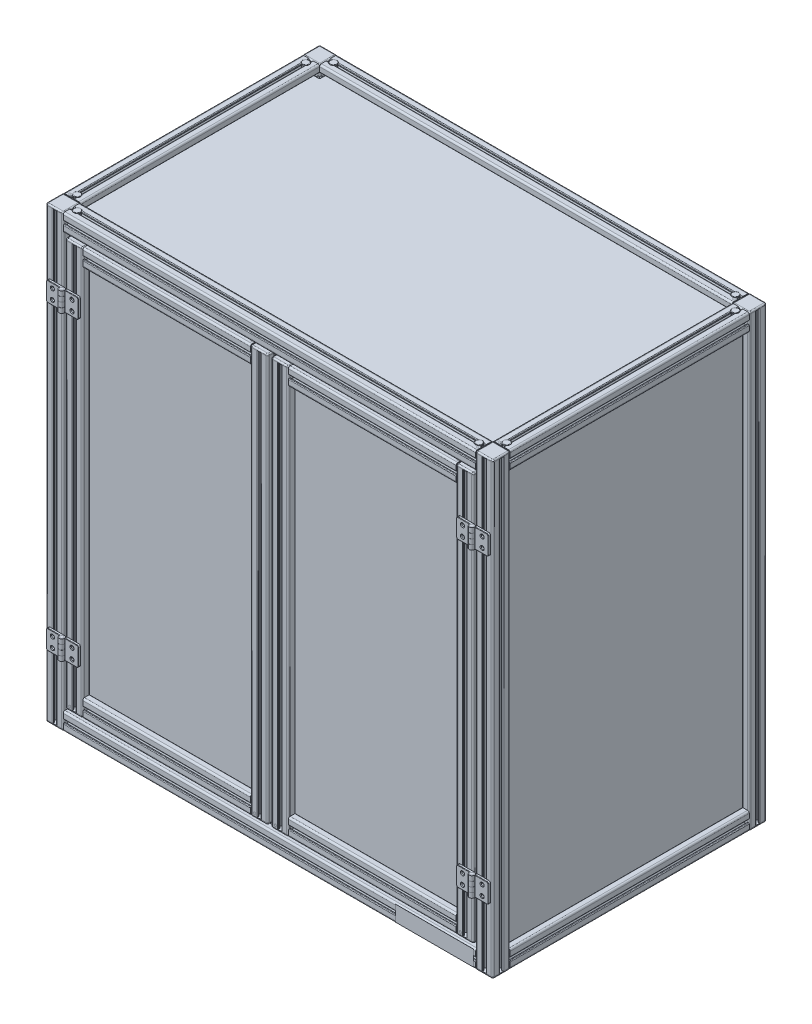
SolidWorks part; units mm, degrees
other "<202276-0001_Schutzzaun Roboterzelle V1 D - A>-<Kopie (2) von Profil 8 40x40 leicht natur^SW045361_ZV-A _ ZV-A.STEP-1/Kopie von AS0041460^Kopie (2) von Profil 8 40x40 leicht natur_SW045361.STEP-1-soli"
other "<202276-0001_Schutzzaun Roboterzelle V1 D - A>-<Kopie (2) von Profil 8 40x40 leicht natur^SW045361_ZV-A _ ZV-A.STEP-1/Kopie von AS0041460^Kopie (2) von Profil 8 40x40 leicht natur_SW045361.STEP-1-soli"
other "<202276-0001_Schutzzaun Roboterzelle V1 D - A>-<Kopie (2) von Profil 8 40x40 leicht natur^SW045361_ZV-A _ ZV-A.STEP-1/Kopie von AS0041460^Kopie (2) von Profil 8 40x40 leicht natur_SW045361.STEP-1-soli"
other "<202276-0001_Schutzzaun Roboterzelle V1 D - A>-<Kopie (2) von Profil 8 40x40 leicht natur^SW045361_ZV-A _ ZV-A.STEP-1/Profil 8 40x40 leicht natur^Kopie (2) von Profil 8 40x40 leicht natur_SW045361_ZV-"
other "<202276-0001_Schutzzaun Roboterzelle V1 D - A>-<Kopie von Profil 8 40x40 leicht natur^SW045361_-- _ --.STEP-4/Profil 8 40x40 leicht natur^Kopie von Profil 8 40x40 leicht natur_SW045361_--_--.STEP-1-so"
other "<202276-0001_Schutzzaun Roboterzelle V1 D - A>-<Kopie von Profil 8 40x40 leicht natur^SW045361_-- _ --.STEP-3/Profil 8 40x40 leicht natur^Kopie von Profil 8 40x40 leicht natur_SW045361_--_--.STEP-1-so"
other "<202276-0001_Schutzzaun Roboterzelle V1 D - A>-<Kopie von Profil 8 40x40 leicht natur^SW045361_-- _ --.STEP-2/Profil 8 40x40 leicht natur^Kopie von Profil 8 40x40 leicht natur_SW045361_--_--.STEP-1-so"
other "<202276-0001_Schutzzaun Roboterzelle V1 D - A>-<Kopie von Profil 8 40x40 leicht natur^SW045361_-- _ --.STEP-1/Profil 8 40x40 leicht natur^Kopie von Profil 8 40x40 leicht natur_SW045361_--_--.STEP-1-so"
other "<202276-0001_Schutzzaun Roboterzelle V1 D - A>-<Kopie (2) von Profil 8 40x40 leicht natur^SW045361_ZV-A _ ZV-A.STEP-3/Kopie von AS0041460^Kopie (2) von Profil 8 40x40 leicht natur_SW045361.STEP-1-soli"
other "<202276-0001_Schutzzaun Roboterzelle V1 D - A>-<Kopie (2) von Profil 8 40x40 leicht natur^SW045361_ZV-A _ ZV-A.STEP-3/Profil 8 40x40 leicht natur^Kopie (2) von Profil 8 40x40 leicht natur_SW045361_ZV-"
other "<202276-0001_Schutzzaun Roboterzelle V1 D - A>-<Kopie (2) von Profil 8 40x40 leicht natur^SW045361_ZV-A _ ZV-A.STEP-2/Kopie von AS0041460^Kopie (2) von Profil 8 40x40 leicht natur_SW045361.STEP-2-soli"
other "<202276-0001_Schutzzaun Roboterzelle V1 D - A>-<Kopie (2) von Profil 8 40x40 leicht natur^SW045361_ZV-A _ ZV-A.STEP-2/Kopie von AS0041460^Kopie (2) von Profil 8 40x40 leicht natur_SW045361.STEP-2-soli"
other "<202276-0001_Schutzzaun Roboterzelle V1 D - A>-<Kopie (2) von Profil 8 40x40 leicht natur^SW045361_ZV-A _ ZV-A.STEP-2/Kopie von AS0041460^Kopie (2) von Profil 8 40x40 leicht natur_SW045361.STEP-2-soli"
other "<202276-0001_Schutzzaun Roboterzelle V1 D - A>-<Kopie (2) von Profil 8 40x40 leicht natur^SW045361_ZV-A _ ZV-A.STEP-2/Kopie von AS0041460^Kopie (2) von Profil 8 40x40 leicht natur_SW045361.STEP-2-soli"
other "<202276-0001_Schutzzaun Roboterzelle V1 D - A>-<Kopie (2) von Profil 8 40x40 leicht natur^SW045361_ZV-A _ ZV-A.STEP-2/Kopie von AS0041460^Kopie (2) von Profil 8 40x40 leicht natur_SW045361.STEP-1-soli"
other "<202276-0001_Schutzzaun Roboterzelle V1 D - A>-<Kopie (2) von Profil 8 40x40 leicht natur^SW045361_ZV-A _ ZV-A.STEP-2/Kopie von AS0041460^Kopie (2) von Profil 8 40x40 leicht natur_SW045361.STEP-1-soli"
other "<202276-0001_Schutzzaun Roboterzelle V1 D - A>-<Kopie (2) von Profil 8 40x40 leicht natur^SW045361_ZV-A _ ZV-A.STEP-2/Kopie von AS0041460^Kopie (2) von Profil 8 40x40 leicht natur_SW045361.STEP-1-soli"
other "<202276-0001_Schutzzaun Roboterzelle V1 D - A>-<Kopie (2) von Profil 8 40x40 leicht natur^SW045361_ZV-A _ ZV-A.STEP-2/Kopie von AS0041460^Kopie (2) von Profil 8 40x40 leicht natur_SW045361.STEP-1-soli"
other "<202276-0001_Schutzzaun Roboterzelle V1 D - A>-<Kopie (2) von Profil 8 40x40 leicht natur^SW045361_ZV-A _ ZV-A.STEP-2/Profil 8 40x40 leicht natur^Kopie (2) von Profil 8 40x40 leicht natur_SW045361_ZV-"
other "<202276-0001_Schutzzaun Roboterzelle V1 D - A>-<Kopie (2) von Profil 8 40x40 leicht natur^SW045361_ZV-A _ ZV-A.STEP-1/Kopie von AS0041460^Kopie (2) von Profil 8 40x40 leicht natur_SW045361.STEP-2-soli"
other "<202276-0001_Schutzzaun Roboterzelle V1 D - A>-<Kopie (2) von Profil 8 40x40 leicht natur^SW045361_ZV-A _ ZV-A.STEP-1/Kopie von AS0041460^Kopie (2) von Profil 8 40x40 leicht natur_SW045361.STEP-2-soli"
other "<202276-0001_Schutzzaun Roboterzelle V1 D - A>-<Kopie (2) von Profil 8 40x40 leicht natur^SW045361_ZV-A _ ZV-A.STEP-1/Kopie von AS0041460^Kopie (2) von Profil 8 40x40 leicht natur_SW045361.STEP-2-soli"
other "<202276-0001_Schutzzaun Roboterzelle V1 D - A>-<Kopie (2) von Profil 8 40x40 leicht natur^SW045361_ZV-A _ ZV-A.STEP-1/Kopie von AS0041460^Kopie (2) von Profil 8 40x40 leicht natur_SW045361.STEP-2-soli"
other "<202276-0001_Schutzzaun Roboterzelle V1 D - A>-<Kopie (2) von Profil 8 40x40 leicht natur^SW045361_ZV-A _ ZV-A.STEP-1/Kopie von AS0041460^Kopie (2) von Profil 8 40x40 leicht natur_SW045361.STEP-1-soli"
other "<202276-0001_Schutzzaun Roboterzelle V1 D - A>-<Kopie (2) von Profil 8 40x40 leicht natur^SW045361_ZV-A _ ZV-A.STEP-4/Kopie von AS0041460^Kopie (2) von Profil 8 40x40 leicht natur_SW045361.STEP-2-soli"
other "<202276-0001_Schutzzaun Roboterzelle V1 D - A>-<Kopie (2) von Profil 8 40x40 leicht natur^SW045361_ZV-A _ ZV-A.STEP-4/Kopie von AS0041460^Kopie (2) von Profil 8 40x40 leicht natur_SW045361.STEP-2-soli"
other "<202276-0001_Schutzzaun Roboterzelle V1 D - A>-<Kopie (2) von Profil 8 40x40 leicht natur^SW045361_ZV-A _ ZV-A.STEP-4/Kopie von AS0041460^Kopie (2) von Profil 8 40x40 leicht natur_SW045361.STEP-2-soli"
other "<202276-0001_Schutzzaun Roboterzelle V1 D - A>-<Kopie (2) von Profil 8 40x40 leicht natur^SW045361_ZV-A _ ZV-A.STEP-4/Kopie von AS0041460^Kopie (2) von Profil 8 40x40 leicht natur_SW045361.STEP-2-soli"
other "<202276-0001_Schutzzaun Roboterzelle V1 D - A>-<Kopie (2) von Profil 8 40x40 leicht natur^SW045361_ZV-A _ ZV-A.STEP-4/Kopie von AS0041460^Kopie (2) von Profil 8 40x40 leicht natur_SW045361.STEP-1-soli"
other "<202276-0001_Schutzzaun Roboterzelle V1 D - A>-<Kopie (2) von Profil 8 40x40 leicht natur^SW045361_ZV-A _ ZV-A.STEP-4/Kopie von AS0041460^Kopie (2) von Profil 8 40x40 leicht natur_SW045361.STEP-1-soli"
other "<202276-0001_Schutzzaun Roboterzelle V1 D - A>-<Kopie (2) von Profil 8 40x40 leicht natur^SW045361_ZV-A _ ZV-A.STEP-4/Kopie von AS0041460^Kopie (2) von Profil 8 40x40 leicht natur_SW045361.STEP-1-soli"
other "<202276-0001_Schutzzaun Roboterzelle V1 D - A>-<Kopie (2) von Profil 8 40x40 leicht natur^SW045361_ZV-A _ ZV-A.STEP-4/Kopie von AS0041460^Kopie (2) von Profil 8 40x40 leicht natur_SW045361.STEP-1-soli"
other "<202276-0001_Schutzzaun Roboterzelle V1 D - A>-<Kopie (2) von Profil 8 40x40 leicht natur^SW045361_ZV-A _ ZV-A.STEP-4/Profil 8 40x40 leicht natur^Kopie (2) von Profil 8 40x40 leicht natur_SW045361_ZV-"
other "<202276-0001_Schutzzaun Roboterzelle V1 D - A>-<Kopie (2) von Profil 8 40x40 leicht natur^SW045361_ZV-A _ ZV-A.STEP-3/Kopie von AS0041460^Kopie (2) von Profil 8 40x40 leicht natur_SW045361.STEP-2-soli"
other "<202276-0001_Schutzzaun Roboterzelle V1 D - A>-<Kopie (2) von Profil 8 40x40 leicht natur^SW045361_ZV-A _ ZV-A.STEP-3/Kopie von AS0041460^Kopie (2) von Profil 8 40x40 leicht natur_SW045361.STEP-2-soli"
other "<202276-0001_Schutzzaun Roboterzelle V1 D - A>-<Kopie (2) von Profil 8 40x40 leicht natur^SW045361_ZV-A _ ZV-A.STEP-3/Kopie von AS0041460^Kopie (2) von Profil 8 40x40 leicht natur_SW045361.STEP-2-soli"
other "<202276-0001_Schutzzaun Roboterzelle V1 D - A>-<Kopie (2) von Profil 8 40x40 leicht natur^SW045361_ZV-A _ ZV-A.STEP-3/Kopie von AS0041460^Kopie (2) von Profil 8 40x40 leicht natur_SW045361.STEP-2-soli"
other "<202276-0001_Schutzzaun Roboterzelle V1 D - A>-<Kopie (2) von Profil 8 40x40 leicht natur^SW045361_ZV-A _ ZV-A.STEP-3/Kopie von AS0041460^Kopie (2) von Profil 8 40x40 leicht natur_SW045361.STEP-1-soli"
other "<202276-0001_Schutzzaun Roboterzelle V1 D - A>-<Kopie (2) von Profil 8 40x40 leicht natur^SW045361_ZV-A _ ZV-A.STEP-3/Kopie von AS0041460^Kopie (2) von Profil 8 40x40 leicht natur_SW045361.STEP-1-soli"
other "<202276-0001_Schutzzaun Roboterzelle V1 D - A>-<Kopie (2) von Profil 8 40x40 leicht natur^SW045361_ZV-A _ ZV-A.STEP-3/Kopie von AS0041460^Kopie (2) von Profil 8 40x40 leicht natur_SW045361.STEP-1-soli"
other "<202276-0001_Schutzzaun Roboterzelle V1 D - A>-<Kopie (3) von Profil 8 40x40 leicht natur^SW045361_ZV-A _ ZV-A.STEP-2/Kopie von AS0041460^Kopie (3) von Profil 8 40x40 leicht natur_SW045361.STEP-2-soli"
other "<202276-0001_Schutzzaun Roboterzelle V1 D - A>-<Kopie (3) von Profil 8 40x40 leicht natur^SW045361_ZV-A _ ZV-A.STEP-2/Kopie von AS0041460^Kopie (3) von Profil 8 40x40 leicht natur_SW045361.STEP-2-soli"
other "<202276-0001_Schutzzaun Roboterzelle V1 D - A>-<Kopie (3) von Profil 8 40x40 leicht natur^SW045361_ZV-A _ ZV-A.STEP-2/Kopie von AS0041460^Kopie (3) von Profil 8 40x40 leicht natur_SW045361.STEP-1-soli"
other "<202276-0001_Schutzzaun Roboterzelle V1 D - A>-<Kopie (3) von Profil 8 40x40 leicht natur^SW045361_ZV-A _ ZV-A.STEP-2/Kopie von AS0041460^Kopie (3) von Profil 8 40x40 leicht natur_SW045361.STEP-1-soli"
other "<202276-0001_Schutzzaun Roboterzelle V1 D - A>-<Kopie (3) von Profil 8 40x40 leicht natur^SW045361_ZV-A _ ZV-A.STEP-2/Kopie von AS0041460^Kopie (3) von Profil 8 40x40 leicht natur_SW045361.STEP-1-soli"
other "<202276-0001_Schutzzaun Roboterzelle V1 D - A>-<Kopie (3) von Profil 8 40x40 leicht natur^SW045361_ZV-A _ ZV-A.STEP-2/Kopie von AS0041460^Kopie (3) von Profil 8 40x40 leicht natur_SW045361.STEP-1-soli"
other "<202276-0001_Schutzzaun Roboterzelle V1 D - A>-<Kopie (3) von Profil 8 40x40 leicht natur^SW045361_ZV-A _ ZV-A.STEP-2/Profil 8 40x40 leicht natur^Kopie (3) von Profil 8 40x40 leicht natur_SW045361_ZV-"
other "<202276-0001_Schutzzaun Roboterzelle V1 D - A>-<Kopie (3) von Profil 8 40x40 leicht natur^SW045361_ZV-A _ ZV-A.STEP-1/Kopie von AS0041460^Kopie (3) von Profil 8 40x40 leicht natur_SW045361.STEP-2-soli"
other "<202276-0001_Schutzzaun Roboterzelle V1 D - A>-<Kopie (3) von Profil 8 40x40 leicht natur^SW045361_ZV-A _ ZV-A.STEP-1/Kopie von AS0041460^Kopie (3) von Profil 8 40x40 leicht natur_SW045361.STEP-2-soli"
other "<202276-0001_Schutzzaun Roboterzelle V1 D - A>-<Kopie (3) von Profil 8 40x40 leicht natur^SW045361_ZV-A _ ZV-A.STEP-1/Kopie von AS0041460^Kopie (3) von Profil 8 40x40 leicht natur_SW045361.STEP-2-soli"
other "<202276-0001_Schutzzaun Roboterzelle V1 D - A>-<Kopie (3) von Profil 8 40x40 leicht natur^SW045361_ZV-A _ ZV-A.STEP-1/Kopie von AS0041460^Kopie (3) von Profil 8 40x40 leicht natur_SW045361.STEP-2-soli"
other "<202276-0001_Schutzzaun Roboterzelle V1 D - A>-<Kopie (3) von Profil 8 40x40 leicht natur^SW045361_ZV-A _ ZV-A.STEP-1/Kopie von AS0041460^Kopie (3) von Profil 8 40x40 leicht natur_SW045361.STEP-1-soli"
other "<202276-0001_Schutzzaun Roboterzelle V1 D - A>-<Kopie (3) von Profil 8 40x40 leicht natur^SW045361_ZV-A _ ZV-A.STEP-1/Kopie von AS0041460^Kopie (3) von Profil 8 40x40 leicht natur_SW045361.STEP-1-soli"
other "<202276-0001_Schutzzaun Roboterzelle V1 D - A>-<Kopie (3) von Profil 8 40x40 leicht natur^SW045361_ZV-A _ ZV-A.STEP-1/Kopie von AS0041460^Kopie (3) von Profil 8 40x40 leicht natur_SW045361.STEP-1-soli"
other "<202276-0001_Schutzzaun Roboterzelle V1 D - A>-<Kopie (3) von Profil 8 40x40 leicht natur^SW045361_ZV-A _ ZV-A.STEP-1/Kopie von AS0041460^Kopie (3) von Profil 8 40x40 leicht natur_SW045361.STEP-1-soli"
other "<202276-0001_Schutzzaun Roboterzelle V1 D - A>-<Kopie (3) von Profil 8 40x40 leicht natur^SW045361_ZV-A _ ZV-A.STEP-1/Profil 8 40x40 leicht natur^Kopie (3) von Profil 8 40x40 leicht natur_SW045361_ZV-"
other "<202276-0001_Schutzzaun Roboterzelle V1 D - A>-<Kopie (3) von Profil 8 40x40 leicht natur^SW045361_ZV-A _ ZV-A.STEP-4/Kopie von AS0041460^Kopie (3) von Profil 8 40x40 leicht natur_SW045361.STEP-1-soli"
other "<202276-0001_Schutzzaun Roboterzelle V1 D - A>-<Kopie (3) von Profil 8 40x40 leicht natur^SW045361_ZV-A _ ZV-A.STEP-4/Kopie von AS0041460^Kopie (3) von Profil 8 40x40 leicht natur_SW045361.STEP-1-soli"
other "<202276-0001_Schutzzaun Roboterzelle V1 D - A>-<Kopie (3) von Profil 8 40x40 leicht natur^SW045361_ZV-A _ ZV-A.STEP-4/Kopie von AS0041460^Kopie (3) von Profil 8 40x40 leicht natur_SW045361.STEP-1-soli"
other "<202276-0001_Schutzzaun Roboterzelle V1 D - A>-<Kopie (3) von Profil 8 40x40 leicht natur^SW045361_ZV-A _ ZV-A.STEP-4/Kopie von AS0041460^Kopie (3) von Profil 8 40x40 leicht natur_SW045361.STEP-1-soli"
other "<202276-0001_Schutzzaun Roboterzelle V1 D - A>-<Kopie (3) von Profil 8 40x40 leicht natur^SW045361_ZV-A _ ZV-A.STEP-4/Profil 8 40x40 leicht natur^Kopie (3) von Profil 8 40x40 leicht natur_SW045361_ZV-"
other "<202276-0001_Schutzzaun Roboterzelle V1 D - A>-<Kopie (3) von Profil 8 40x40 leicht natur^SW045361_ZV-A _ ZV-A.STEP-3/Kopie von AS0041460^Kopie (3) von Profil 8 40x40 leicht natur_SW045361.STEP-2-soli"
other "<202276-0001_Schutzzaun Roboterzelle V1 D - A>-<Kopie (3) von Profil 8 40x40 leicht natur^SW045361_ZV-A _ ZV-A.STEP-3/Kopie von AS0041460^Kopie (3) von Profil 8 40x40 leicht natur_SW045361.STEP-2-soli"
other "<202276-0001_Schutzzaun Roboterzelle V1 D - A>-<Kopie (3) von Profil 8 40x40 leicht natur^SW045361_ZV-A _ ZV-A.STEP-3/Kopie von AS0041460^Kopie (3) von Profil 8 40x40 leicht natur_SW045361.STEP-2-soli"
other "<202276-0001_Schutzzaun Roboterzelle V1 D - A>-<Kopie (3) von Profil 8 40x40 leicht natur^SW045361_ZV-A _ ZV-A.STEP-3/Kopie von AS0041460^Kopie (3) von Profil 8 40x40 leicht natur_SW045361.STEP-2-soli"
other "<202276-0001_Schutzzaun Roboterzelle V1 D - A>-<Kopie (3) von Profil 8 40x40 leicht natur^SW045361_ZV-A _ ZV-A.STEP-3/Kopie von AS0041460^Kopie (3) von Profil 8 40x40 leicht natur_SW045361.STEP-1-soli"
other "<202276-0001_Schutzzaun Roboterzelle V1 D - A>-<Kopie (3) von Profil 8 40x40 leicht natur^SW045361_ZV-A _ ZV-A.STEP-3/Kopie von AS0041460^Kopie (3) von Profil 8 40x40 leicht natur_SW045361.STEP-1-soli"
other "<202276-0001_Schutzzaun Roboterzelle V1 D - A>-<Kopie (3) von Profil 8 40x40 leicht natur^SW045361_ZV-A _ ZV-A.STEP-3/Kopie von AS0041460^Kopie (3) von Profil 8 40x40 leicht natur_SW045361.STEP-1-soli"
other "<202276-0001_Schutzzaun Roboterzelle V1 D - A>-<Kopie (3) von Profil 8 40x40 leicht natur^SW045361_ZV-A _ ZV-A.STEP-3/Kopie von AS0041460^Kopie (3) von Profil 8 40x40 leicht natur_SW045361.STEP-1-soli"
other "<202276-0001_Schutzzaun Roboterzelle V1 D - A>-<Kopie (3) von Profil 8 40x40 leicht natur^SW045361_ZV-A _ ZV-A.STEP-3/Profil 8 40x40 leicht natur^Kopie (3) von Profil 8 40x40 leicht natur_SW045361_ZV-"
other "<202276-0001_Schutzzaun Roboterzelle V1 D - A>-<Kopie (3) von Profil 8 40x40 leicht natur^SW045361_ZV-A _ ZV-A.STEP-2/Kopie von AS0041460^Kopie (3) von Profil 8 40x40 leicht natur_SW045361.STEP-2-soli"
other "<202276-0001_Schutzzaun Roboterzelle V1 D - A>-<Kopie (3) von Profil 8 40x40 leicht natur^SW045361_ZV-A _ ZV-A.STEP-2/Kopie von AS0041460^Kopie (3) von Profil 8 40x40 leicht natur_SW045361.STEP-2-soli"
other "<202276-0001_Schutzzaun Roboterzelle V1 D - A>-<Abdeckkappen_PB08 - 08 - 40x40 (40015) s.STEP-12/Abdeckkappen_PB08 - 08 - 40x40 (40015) s-0.STEP-1-solid1>"
other "<202276-0001_Schutzzaun Roboterzelle V1 D - A>-<Abdeckkappen_PB08 - 08 - 40x40 (40015) s.STEP-11/Abdeckkappen_PB08 - 08 - 40x40 (40015) s-0.STEP-1-solid1>"
other "<202276-0001_Schutzzaun Roboterzelle V1 D - A>-<Abdeckkappen_PB08 - 08 - 40x40 (40015) s.STEP-10/Abdeckkappen_PB08 - 08 - 40x40 (40015) s-0.STEP-1-solid1>"
other "<202276-0001_Schutzzaun Roboterzelle V1 D - A>-<Abdeckkappen_PB08 - 08 - 40x40 (40015) s.STEP-9/Abdeckkappen_PB08 - 08 - 40x40 (40015) s-0.STEP-1-solid1>"
other "<202276-0001_Schutzzaun Roboterzelle V1 D - A>-<Abdeckkappen_PB08 - 08 - 40x40 (40015) s.STEP-8/Abdeckkappen_PB08 - 08 - 40x40 (40015) s-0.STEP-1-solid1>"
other "<202276-0001_Schutzzaun Roboterzelle V1 D - A>-<Abdeckkappen_PB08 - 08 - 40x40 (40015) s.STEP-7/Abdeckkappen_PB08 - 08 - 40x40 (40015) s-0.STEP-1-solid1>"
other "<202276-0001_Schutzzaun Roboterzelle V1 D - A>-<Abdeckkappen_PB08 - 08 - 40x40 (40015) s.STEP-6/Abdeckkappen_PB08 - 08 - 40x40 (40015) s-0.STEP-1-solid1>"
other "<202276-0001_Schutzzaun Roboterzelle V1 D - A>-<Abdeckkappen_PB08 - 08 - 40x40 (40015) s.STEP-5/Abdeckkappen_PB08 - 08 - 40x40 (40015) s-0.STEP-1-solid1>"
other "<202276-0001_Schutzzaun Roboterzelle V1 D - A>-<Abdeckkappen_PB08 - 08 - 40x40 (40015) s.STEP-4/Abdeckkappen_PB08 - 08 - 40x40 (40015) s-0.STEP-1-solid1>"
other "<202276-0001_Schutzzaun Roboterzelle V1 D - A>-<Abdeckkappen_PB08 - 08 - 40x40 (40015) s.STEP-3/Abdeckkappen_PB08 - 08 - 40x40 (40015) s-0.STEP-1-solid1>"
other "<202276-0001_Schutzzaun Roboterzelle V1 D - A>-<Abdeckkappen_PB08 - 08 - 40x40 (40015) s.STEP-2/Abdeckkappen_PB08 - 08 - 40x40 (40015) s-0.STEP-1-solid1>"
other "<202276-0001_Schutzzaun Roboterzelle V1 D - A>-<Abdeckkappen_PB08 - 08 - 40x40 (40015) s.STEP-1/Abdeckkappen_PB08 - 08 - 40x40 (40015) s-0.STEP-1-solid1>"
other "<202276-0001_Schutzzaun Roboterzelle V1 D - A>-<Kopie (3) von Profil 8 40x40 leicht natur^SW045361_ZV-A _ ZV-A.STEP-4/Kopie von AS0041460^Kopie (3) von Profil 8 40x40 leicht natur_SW045361.STEP-2-soli"
other "<202276-0001_Schutzzaun Roboterzelle V1 D - A>-<Kopie (3) von Profil 8 40x40 leicht natur^SW045361_ZV-A _ ZV-A.STEP-4/Kopie von AS0041460^Kopie (3) von Profil 8 40x40 leicht natur_SW045361.STEP-2-soli"
other "<202276-0001_Schutzzaun Roboterzelle V1 D - A>-<Kopie (3) von Profil 8 40x40 leicht natur^SW045361_ZV-A _ ZV-A.STEP-4/Kopie von AS0041460^Kopie (3) von Profil 8 40x40 leicht natur_SW045361.STEP-2-soli"
other "<202276-0001_Schutzzaun Roboterzelle V1 D - A>-<Kopie (3) von Profil 8 40x40 leicht natur^SW045361_ZV-A _ ZV-A.STEP-4/Kopie von AS0041460^Kopie (3) von Profil 8 40x40 leicht natur_SW045361.STEP-2-soli"
other "<202276-0001_Schutzzaun Roboterzelle V1 D - A>-<Kopie (5) von Profil 8 40x40 leicht natur^SW045361_ZV-A _ ZV-A.STEP-1/Kopie von AS0041460^Kopie (5) von Profil 8 40x40 leicht natur_SW045361.STEP-2-soli"
other "<202276-0001_Schutzzaun Roboterzelle V1 D - A>-<Kopie (5) von Profil 8 40x40 leicht natur^SW045361_ZV-A _ ZV-A.STEP-1/Kopie von AS0041460^Kopie (5) von Profil 8 40x40 leicht natur_SW045361.STEP-2-soli"
other "<202276-0001_Schutzzaun Roboterzelle V1 D - A>-<Kopie (5) von Profil 8 40x40 leicht natur^SW045361_ZV-A _ ZV-A.STEP-1/Kopie von AS0041460^Kopie (5) von Profil 8 40x40 leicht natur_SW045361.STEP-2-soli"
other "<202276-0001_Schutzzaun Roboterzelle V1 D - A>-<Kopie (5) von Profil 8 40x40 leicht natur^SW045361_ZV-A _ ZV-A.STEP-1/Kopie von AS0041460^Kopie (5) von Profil 8 40x40 leicht natur_SW045361.STEP-1-soli"
other "<202276-0001_Schutzzaun Roboterzelle V1 D - A>-<Kopie (5) von Profil 8 40x40 leicht natur^SW045361_ZV-A _ ZV-A.STEP-1/Kopie von AS0041460^Kopie (5) von Profil 8 40x40 leicht natur_SW045361.STEP-1-soli"
other "<202276-0001_Schutzzaun Roboterzelle V1 D - A>-<Kopie (5) von Profil 8 40x40 leicht natur^SW045361_ZV-A _ ZV-A.STEP-1/Kopie von AS0041460^Kopie (5) von Profil 8 40x40 leicht natur_SW045361.STEP-1-soli"
other "<202276-0001_Schutzzaun Roboterzelle V1 D - A>-<Kopie (5) von Profil 8 40x40 leicht natur^SW045361_ZV-A _ ZV-A.STEP-1/Kopie von AS0041460^Kopie (5) von Profil 8 40x40 leicht natur_SW045361.STEP-1-soli"
other "<202276-0001_Schutzzaun Roboterzelle V1 D - A>-<Kopie (5) von Profil 8 40x40 leicht natur^SW045361_ZV-A _ ZV-A.STEP-1/Profil 8 40x40 leicht natur^Kopie (5) von Profil 8 40x40 leicht natur_SW045361_ZV-"
other "<202276-0001_Schutzzaun Roboterzelle V1 D - A>-<Kopie (4) von Profil 8 40x40 leicht natur^SW045361_-- _ --.STEP-4/Profil 8 40x40 leicht natur^Kopie (4) von Profil 8 40x40 leicht natur_SW045361_--_--.S"
other "<202276-0001_Schutzzaun Roboterzelle V1 D - A>-<Kopie (4) von Profil 8 40x40 leicht natur^SW045361_-- _ --.STEP-3/Profil 8 40x40 leicht natur^Kopie (4) von Profil 8 40x40 leicht natur_SW045361_--_--.S"
other "<202276-0001_Schutzzaun Roboterzelle V1 D - A>-<Kopie (4) von Profil 8 40x40 leicht natur^SW045361_-- _ --.STEP-2/Profil 8 40x40 leicht natur^Kopie (4) von Profil 8 40x40 leicht natur_SW045361_--_--.S"
other "<202276-0001_Schutzzaun Roboterzelle V1 D - A>-<Kopie (4) von Profil 8 40x40 leicht natur^SW045361_-- _ --.STEP-1/Profil 8 40x40 leicht natur^Kopie (4) von Profil 8 40x40 leicht natur_SW045361_--_--.S"
other "<202276-0001_Schutzzaun Roboterzelle V1 D - A>-<Abdeckkappen_PB08 - 08 - 40x40 (40015) s.STEP-16/Abdeckkappen_PB08 - 08 - 40x40 (40015) s-0.STEP-1-solid1>"
other "<202276-0001_Schutzzaun Roboterzelle V1 D - A>-<Abdeckkappen_PB08 - 08 - 40x40 (40015) s.STEP-15/Abdeckkappen_PB08 - 08 - 40x40 (40015) s-0.STEP-1-solid1>"
other "<202276-0001_Schutzzaun Roboterzelle V1 D - A>-<Abdeckkappen_PB08 - 08 - 40x40 (40015) s.STEP-14/Abdeckkappen_PB08 - 08 - 40x40 (40015) s-0.STEP-1-solid1>"
other "<202276-0001_Schutzzaun Roboterzelle V1 D - A>-<Abdeckkappen_PB08 - 08 - 40x40 (40015) s.STEP-13/Abdeckkappen_PB08 - 08 - 40x40 (40015) s-0.STEP-1-solid1>"
other "<202276-0001_Schutzzaun Roboterzelle V1 D - A>-<Kopie (5) von Profil 8 40x40 leicht natur^SW045361_ZV-A _ ZV-A.STEP-3/Kopie von AS0041460^Kopie (5) von Profil 8 40x40 leicht natur_SW045361.STEP-2-soli"
other "<202276-0001_Schutzzaun Roboterzelle V1 D - A>-<Kopie (5) von Profil 8 40x40 leicht natur^SW045361_ZV-A _ ZV-A.STEP-3/Kopie von AS0041460^Kopie (5) von Profil 8 40x40 leicht natur_SW045361.STEP-1-soli"
other "<202276-0001_Schutzzaun Roboterzelle V1 D - A>-<Kopie (5) von Profil 8 40x40 leicht natur^SW045361_ZV-A _ ZV-A.STEP-3/Kopie von AS0041460^Kopie (5) von Profil 8 40x40 leicht natur_SW045361.STEP-1-soli"
other "<202276-0001_Schutzzaun Roboterzelle V1 D - A>-<Kopie (5) von Profil 8 40x40 leicht natur^SW045361_ZV-A _ ZV-A.STEP-3/Kopie von AS0041460^Kopie (5) von Profil 8 40x40 leicht natur_SW045361.STEP-1-soli"
other "<202276-0001_Schutzzaun Roboterzelle V1 D - A>-<Kopie (5) von Profil 8 40x40 leicht natur^SW045361_ZV-A _ ZV-A.STEP-3/Kopie von AS0041460^Kopie (5) von Profil 8 40x40 leicht natur_SW045361.STEP-1-soli"
other "<202276-0001_Schutzzaun Roboterzelle V1 D - A>-<Kopie (5) von Profil 8 40x40 leicht natur^SW045361_ZV-A _ ZV-A.STEP-3/Profil 8 40x40 leicht natur^Kopie (5) von Profil 8 40x40 leicht natur_SW045361_ZV-"
other "<202276-0001_Schutzzaun Roboterzelle V1 D - A>-<Kopie (5) von Profil 8 40x40 leicht natur^SW045361_ZV-A _ ZV-A.STEP-2/Kopie von AS0041460^Kopie (5) von Profil 8 40x40 leicht natur_SW045361.STEP-2-soli"
other "<202276-0001_Schutzzaun Roboterzelle V1 D - A>-<Kopie (5) von Profil 8 40x40 leicht natur^SW045361_ZV-A _ ZV-A.STEP-2/Kopie von AS0041460^Kopie (5) von Profil 8 40x40 leicht natur_SW045361.STEP-2-soli"
other "<202276-0001_Schutzzaun Roboterzelle V1 D - A>-<Kopie (5) von Profil 8 40x40 leicht natur^SW045361_ZV-A _ ZV-A.STEP-2/Kopie von AS0041460^Kopie (5) von Profil 8 40x40 leicht natur_SW045361.STEP-2-soli"
other "<202276-0001_Schutzzaun Roboterzelle V1 D - A>-<Kopie (5) von Profil 8 40x40 leicht natur^SW045361_ZV-A _ ZV-A.STEP-2/Kopie von AS0041460^Kopie (5) von Profil 8 40x40 leicht natur_SW045361.STEP-2-soli"
other "<202276-0001_Schutzzaun Roboterzelle V1 D - A>-<Kopie (5) von Profil 8 40x40 leicht natur^SW045361_ZV-A _ ZV-A.STEP-2/Kopie von AS0041460^Kopie (5) von Profil 8 40x40 leicht natur_SW045361.STEP-1-soli"
other "<202276-0001_Schutzzaun Roboterzelle V1 D - A>-<Kopie (5) von Profil 8 40x40 leicht natur^SW045361_ZV-A _ ZV-A.STEP-2/Kopie von AS0041460^Kopie (5) von Profil 8 40x40 leicht natur_SW045361.STEP-1-soli"
other "<202276-0001_Schutzzaun Roboterzelle V1 D - A>-<Kopie (5) von Profil 8 40x40 leicht natur^SW045361_ZV-A _ ZV-A.STEP-2/Kopie von AS0041460^Kopie (5) von Profil 8 40x40 leicht natur_SW045361.STEP-1-soli"
other "<202276-0001_Schutzzaun Roboterzelle V1 D - A>-<Kopie (5) von Profil 8 40x40 leicht natur^SW045361_ZV-A _ ZV-A.STEP-2/Kopie von AS0041460^Kopie (5) von Profil 8 40x40 leicht natur_SW045361.STEP-1-soli"
other "<202276-0001_Schutzzaun Roboterzelle V1 D - A>-<Kopie (5) von Profil 8 40x40 leicht natur^SW045361_ZV-A _ ZV-A.STEP-2/Profil 8 40x40 leicht natur^Kopie (5) von Profil 8 40x40 leicht natur_SW045361_ZV-"
other "<202276-0001_Schutzzaun Roboterzelle V1 D - A>-<Kopie (5) von Profil 8 40x40 leicht natur^SW045361_ZV-A _ ZV-A.STEP-1/Kopie von AS0041460^Kopie (5) von Profil 8 40x40 leicht natur_SW045361.STEP-2-soli"
other "<202276-0001_Schutzzaun Roboterzelle V1 D - A>-<Universalwinkel_ohne Befestigungssatz.STEP-4/Universalwinkelsaetze_Universalwinkel ESD.STEP-1-solid1>"
other "<202276-0001_Schutzzaun Roboterzelle V1 D - A>-<Universalwinkel_ohne Befestigungssatz.STEP-3/Universalwinkelsaetze_Universalwinkel ESD.STEP-1-solid1>"
other "<202276-0001_Schutzzaun Roboterzelle V1 D - A>-<Universalwinkel_ohne Befestigungssatz.STEP-2/Universalwinkelsaetze_Universalwinkel ESD.STEP-1-solid1>"
other "<202276-0001_Schutzzaun Roboterzelle V1 D - A>-<Universalwinkel_ohne Befestigungssatz.STEP-1/Universalwinkelsaetze_Universalwinkel ESD.STEP-1-solid1>"
other "<202276-0001_Schutzzaun Roboterzelle V1 D - A>-<Kopie (5) von Profil 8 40x40 leicht natur^SW045361_ZV-A _ ZV-A.STEP-4/Kopie von AS0041460^Kopie (5) von Profil 8 40x40 leicht natur_SW045361.STEP-2-soli"
other "<202276-0001_Schutzzaun Roboterzelle V1 D - A>-<Kopie (5) von Profil 8 40x40 leicht natur^SW045361_ZV-A _ ZV-A.STEP-4/Kopie von AS0041460^Kopie (5) von Profil 8 40x40 leicht natur_SW045361.STEP-2-soli"
other "<202276-0001_Schutzzaun Roboterzelle V1 D - A>-<Kopie (5) von Profil 8 40x40 leicht natur^SW045361_ZV-A _ ZV-A.STEP-4/Kopie von AS0041460^Kopie (5) von Profil 8 40x40 leicht natur_SW045361.STEP-2-soli"
other "<202276-0001_Schutzzaun Roboterzelle V1 D - A>-<Kopie (5) von Profil 8 40x40 leicht natur^SW045361_ZV-A _ ZV-A.STEP-4/Kopie von AS0041460^Kopie (5) von Profil 8 40x40 leicht natur_SW045361.STEP-2-soli"
other "<202276-0001_Schutzzaun Roboterzelle V1 D - A>-<Kopie (5) von Profil 8 40x40 leicht natur^SW045361_ZV-A _ ZV-A.STEP-4/Kopie von AS0041460^Kopie (5) von Profil 8 40x40 leicht natur_SW045361.STEP-1-soli"
other "<202276-0001_Schutzzaun Roboterzelle V1 D - A>-<Kopie (5) von Profil 8 40x40 leicht natur^SW045361_ZV-A _ ZV-A.STEP-4/Kopie von AS0041460^Kopie (5) von Profil 8 40x40 leicht natur_SW045361.STEP-1-soli"
other "<202276-0001_Schutzzaun Roboterzelle V1 D - A>-<Kopie (5) von Profil 8 40x40 leicht natur^SW045361_ZV-A _ ZV-A.STEP-4/Kopie von AS0041460^Kopie (5) von Profil 8 40x40 leicht natur_SW045361.STEP-1-soli"
other "<202276-0001_Schutzzaun Roboterzelle V1 D - A>-<Kopie (5) von Profil 8 40x40 leicht natur^SW045361_ZV-A _ ZV-A.STEP-4/Kopie von AS0041460^Kopie (5) von Profil 8 40x40 leicht natur_SW045361.STEP-1-soli"
other "<202276-0001_Schutzzaun Roboterzelle V1 D - A>-<Kopie (5) von Profil 8 40x40 leicht natur^SW045361_ZV-A _ ZV-A.STEP-4/Profil 8 40x40 leicht natur^Kopie (5) von Profil 8 40x40 leicht natur_SW045361_ZV-"
other "<202276-0001_Schutzzaun Roboterzelle V1 D - A>-<Kopie (5) von Profil 8 40x40 leicht natur^SW045361_ZV-A _ ZV-A.STEP-3/Kopie von AS0041460^Kopie (5) von Profil 8 40x40 leicht natur_SW045361.STEP-2-soli"
other "<202276-0001_Schutzzaun Roboterzelle V1 D - A>-<Kopie (5) von Profil 8 40x40 leicht natur^SW045361_ZV-A _ ZV-A.STEP-3/Kopie von AS0041460^Kopie (5) von Profil 8 40x40 leicht natur_SW045361.STEP-2-soli"
other "<202276-0001_Schutzzaun Roboterzelle V1 D - A>-<Kopie (5) von Profil 8 40x40 leicht natur^SW045361_ZV-A _ ZV-A.STEP-3/Kopie von AS0041460^Kopie (5) von Profil 8 40x40 leicht natur_SW045361.STEP-2-soli"
other "<202276-0001_Schutzzaun Roboterzelle V1 D - A>-<SW045362_HPL - 05.STEP-1-solid1>"
other "<202276-0001_Schutzzaun Roboterzelle V1 D - A>-<AS0010452.STEP-2-solid1>"
other "<202276-0001_Schutzzaun Roboterzelle V1 D - A>-<AS0010452.STEP-1-solid1>"
other "<202276-0001_Schutzzaun Roboterzelle V1 D - A>-<Typenschild-Aufkleber_Normal.STEP-1/Typenschild-Aufkleber_Typenschild.STEP-1-solid1>"
other "<202276-0001_Schutzzaun Roboterzelle V1 D - A>-<AS0013820.STEP-4/AS0013820_02.STEP-2-solid1>"
other "<202276-0001_Schutzzaun Roboterzelle V1 D - A>-<AS0013820.STEP-4/AS0013820_02.STEP-1-solid1>"
other "<202276-0001_Schutzzaun Roboterzelle V1 D - A>-<AS0013820.STEP-4/AS0013820_01.STEP-1-solid1>"
other "<202276-0001_Schutzzaun Roboterzelle V1 D - A>-<AS0013820.STEP-3/AS0013820_02.STEP-2-solid1>"
other "<202276-0001_Schutzzaun Roboterzelle V1 D - A>-<AS0013820.STEP-3/AS0013820_02.STEP-1-solid1>"
other "<202276-0001_Schutzzaun Roboterzelle V1 D - A>-<AS0013820.STEP-3/AS0013820_01.STEP-1-solid1>"
other "<202276-0001_Schutzzaun Roboterzelle V1 D - A>-<AS0013820.STEP-2/AS0013820_02.STEP-2-solid1>"
other "<202276-0001_Schutzzaun Roboterzelle V1 D - A>-<AS0013820.STEP-2/AS0013820_02.STEP-1-solid1>"
other "<202276-0001_Schutzzaun Roboterzelle V1 D - A>-<AS0013820.STEP-2/AS0013820_01.STEP-1-solid1>"
other "<202276-0001_Schutzzaun Roboterzelle V1 D - A>-<AS0013820.STEP-1/AS0013820_02.STEP-2-solid1>"
other "<202276-0001_Schutzzaun Roboterzelle V1 D - A>-<AS0013820.STEP-1/AS0013820_02.STEP-1-solid1>"
other "<202276-0001_Schutzzaun Roboterzelle V1 D - A>-<AS0013820.STEP-1/AS0013820_01.STEP-1-solid1>"
other "<202276-0001_Schutzzaun Roboterzelle V1 D - A>-<SW045365_HPL - 05.STEP-1-solid1>"
other "<202276-0001_Schutzzaun Roboterzelle V1 D - A>-<SW045364_HPL - 05.STEP-2-solid1>"
other "<202276-0001_Schutzzaun Roboterzelle V1 D - A>-<SW045364_HPL - 05.STEP-1-solid1>"
other "<202276-0001_Schutzzaun Roboterzelle V1 D - A>-<SW045363_HPL - 05.STEP-1-solid1>"
other "<202276-0001_Schutzzaun Roboterzelle V1 D - A>-<SW045362_HPL - 05.STEP-2-solid1>"
ref_plane "Ebene vorne" through (0, 0, 0) normal (0, 0, 1) x (1, 0, 0)
ref_plane "Ebene oben" through (0, 0, 0) normal (0, 1, 0) x (1, 0, 0)
ref_plane "Ebene rechts" through (0, 0, 0) normal (1, 0, 0) x (0, 0, -1)
imported_body "Kopie von Profil 8 40x40 leicht natur^SW045361_-- _ ---1/Profil 8 40x40 leicht natur^Kopie von Profil 8 40x40 leicht natur_SW045361_--_---1-solid1"
imported_body "Kopie von Profil 8 40x40 leicht natur^SW045361_-- _ ---2/Profil 8 40x40 leicht natur^Kopie von Profil 8 40x40 leicht natur_SW045361_--_---1-solid1"
imported_body "Kopie von Profil 8 40x40 leicht natur^SW045361_-- _ ---3/Profil 8 40x40 leicht natur^Kopie von Profil 8 40x40 leicht natur_SW045361_--_---1-solid1"
imported_body "Kopie von Profil 8 40x40 leicht natur^SW045361_-- _ ---4/Profil 8 40x40 leicht natur^Kopie von Profil 8 40x40 leicht natur_SW045361_--_---1-solid1"
imported_body "Kopie (2) von Profil 8 40x40 leicht natur^SW045361_A-A _ A-A-1/Profil 8 40x40 leicht natur^Kopie (2) von Profil 8 40x40 leicht natur_SW045361_A-A _ A-A-1-solid1"
imported_body "Kopie (2) von Profil 8 40x40 leicht natur^SW045361_A-A _ A-A-1/Kopie von Automatikverbinder^Kopie (2) von Profil 8 40x40 leicht natur_SW045361_PB 8 - Nut 8-1/Kopie von Automatikverbinder Huelse^Kopie "
imported_body "Kopie (2) von Profil 8 40x40 leicht natur^SW045361_A-A _ A-A-1/Kopie von Automatikverbinder^Kopie (2) von Profil 8 40x40 leicht natur_SW045361_PB 8 - Nut 8-1/Automatikverbinder Schraube^Kopie von Auto"
imported_body "Kopie (2) von Profil 8 40x40 leicht natur^SW045361_A-A _ A-A-1/Kopie von Automatikverbinder^Kopie (2) von Profil 8 40x40 leicht natur_SW045361_PB 8 - Nut 8-1/Automatikverbinder Nutenstein^Kopie von Au"
imported_body "Kopie (2) von Profil 8 40x40 leicht natur^SW045361_A-A _ A-A-1/Kopie von Automatikverbinder^Kopie (2) von Profil 8 40x40 leicht natur_SW045361_PB 8 - Nut 8-2/Kopie von Automatikverbinder Huelse^Kopie "
imported_body "Kopie (2) von Profil 8 40x40 leicht natur^SW045361_A-A _ A-A-1/Kopie von Automatikverbinder^Kopie (2) von Profil 8 40x40 leicht natur_SW045361_PB 8 - Nut 8-2/Automatikverbinder Schraube^Kopie von Auto"
imported_body "Kopie (2) von Profil 8 40x40 leicht natur^SW045361_A-A _ A-A-1/Kopie von Automatikverbinder^Kopie (2) von Profil 8 40x40 leicht natur_SW045361_PB 8 - Nut 8-2/Automatikverbinder Nutenstein^Kopie von Au"
imported_body "Kopie (2) von Profil 8 40x40 leicht natur^SW045361_A-A _ A-A-2/Profil 8 40x40 leicht natur^Kopie (2) von Profil 8 40x40 leicht natur_SW045361_A-A _ A-A-1-solid1"
imported_body "Kopie (2) von Profil 8 40x40 leicht natur^SW045361_A-A _ A-A-2/Kopie von Automatikverbinder^Kopie (2) von Profil 8 40x40 leicht natur_SW045361_PB 8 - Nut 8-1/Kopie von Automatikverbinder Huelse^Kopie "
imported_body "Kopie (2) von Profil 8 40x40 leicht natur^SW045361_A-A _ A-A-2/Kopie von Automatikverbinder^Kopie (2) von Profil 8 40x40 leicht natur_SW045361_PB 8 - Nut 8-1/Automatikverbinder Schraube^Kopie von Auto"
imported_body "Kopie (2) von Profil 8 40x40 leicht natur^SW045361_A-A _ A-A-2/Kopie von Automatikverbinder^Kopie (2) von Profil 8 40x40 leicht natur_SW045361_PB 8 - Nut 8-1/Automatikverbinder Nutenstein^Kopie von Au"
imported_body "Kopie (2) von Profil 8 40x40 leicht natur^SW045361_A-A _ A-A-2/Kopie von Automatikverbinder^Kopie (2) von Profil 8 40x40 leicht natur_SW045361_PB 8 - Nut 8-2/Kopie von Automatikverbinder Huelse^Kopie "
imported_body "Kopie (2) von Profil 8 40x40 leicht natur^SW045361_A-A _ A-A-2/Kopie von Automatikverbinder^Kopie (2) von Profil 8 40x40 leicht natur_SW045361_PB 8 - Nut 8-2/Automatikverbinder Schraube^Kopie von Auto"
imported_body "Kopie (2) von Profil 8 40x40 leicht natur^SW045361_A-A _ A-A-2/Kopie von Automatikverbinder^Kopie (2) von Profil 8 40x40 leicht natur_SW045361_PB 8 - Nut 8-2/Automatikverbinder Nutenstein^Kopie von Au"
imported_body "Kopie (2) von Profil 8 40x40 leicht natur^SW045361_A-A _ A-A-3/Profil 8 40x40 leicht natur^Kopie (2) von Profil 8 40x40 leicht natur_SW045361_A-A _ A-A-1-solid1"
imported_body "Kopie (2) von Profil 8 40x40 leicht natur^SW045361_A-A _ A-A-3/Kopie von Automatikverbinder^Kopie (2) von Profil 8 40x40 leicht natur_SW045361_PB 8 - Nut 8-1/Kopie von Automatikverbinder Huelse^Kopie "
imported_body "Kopie (2) von Profil 8 40x40 leicht natur^SW045361_A-A _ A-A-3/Kopie von Automatikverbinder^Kopie (2) von Profil 8 40x40 leicht natur_SW045361_PB 8 - Nut 8-1/Automatikverbinder Schraube^Kopie von Auto"
imported_body "Kopie (2) von Profil 8 40x40 leicht natur^SW045361_A-A _ A-A-3/Kopie von Automatikverbinder^Kopie (2) von Profil 8 40x40 leicht natur_SW045361_PB 8 - Nut 8-1/Automatikverbinder Nutenstein^Kopie von Au"
imported_body "Kopie (2) von Profil 8 40x40 leicht natur^SW045361_A-A _ A-A-3/Kopie von Automatikverbinder^Kopie (2) von Profil 8 40x40 leicht natur_SW045361_PB 8 - Nut 8-2/Kopie von Automatikverbinder Huelse^Kopie "
imported_body "Kopie (2) von Profil 8 40x40 leicht natur^SW045361_A-A _ A-A-3/Kopie von Automatikverbinder^Kopie (2) von Profil 8 40x40 leicht natur_SW045361_PB 8 - Nut 8-2/Automatikverbinder Schraube^Kopie von Auto"
imported_body "Kopie (2) von Profil 8 40x40 leicht natur^SW045361_A-A _ A-A-3/Kopie von Automatikverbinder^Kopie (2) von Profil 8 40x40 leicht natur_SW045361_PB 8 - Nut 8-2/Automatikverbinder Nutenstein^Kopie von Au"
imported_body "Kopie (2) von Profil 8 40x40 leicht natur^SW045361_A-A _ A-A-4/Profil 8 40x40 leicht natur^Kopie (2) von Profil 8 40x40 leicht natur_SW045361_A-A _ A-A-1-solid1"
imported_body "Kopie (2) von Profil 8 40x40 leicht natur^SW045361_A-A _ A-A-4/Kopie von Automatikverbinder^Kopie (2) von Profil 8 40x40 leicht natur_SW045361_PB 8 - Nut 8-1/Kopie von Automatikverbinder Huelse^Kopie "
imported_body "Kopie (2) von Profil 8 40x40 leicht natur^SW045361_A-A _ A-A-4/Kopie von Automatikverbinder^Kopie (2) von Profil 8 40x40 leicht natur_SW045361_PB 8 - Nut 8-1/Automatikverbinder Schraube^Kopie von Auto"
imported_body "Kopie (2) von Profil 8 40x40 leicht natur^SW045361_A-A _ A-A-4/Kopie von Automatikverbinder^Kopie (2) von Profil 8 40x40 leicht natur_SW045361_PB 8 - Nut 8-1/Automatikverbinder Nutenstein^Kopie von Au"
imported_body "Kopie (2) von Profil 8 40x40 leicht natur^SW045361_A-A _ A-A-4/Kopie von Automatikverbinder^Kopie (2) von Profil 8 40x40 leicht natur_SW045361_PB 8 - Nut 8-2/Kopie von Automatikverbinder Huelse^Kopie "
imported_body "Kopie (2) von Profil 8 40x40 leicht natur^SW045361_A-A _ A-A-4/Kopie von Automatikverbinder^Kopie (2) von Profil 8 40x40 leicht natur_SW045361_PB 8 - Nut 8-2/Automatikverbinder Schraube^Kopie von Auto"
imported_body "Kopie (2) von Profil 8 40x40 leicht natur^SW045361_A-A _ A-A-4/Kopie von Automatikverbinder^Kopie (2) von Profil 8 40x40 leicht natur_SW045361_PB 8 - Nut 8-2/Automatikverbinder Nutenstein^Kopie von Au"
imported_body "Kopie (3) von Profil 8 40x40 leicht natur^SW045361_A-A _ A-A-1/Profil 8 40x40 leicht natur^Kopie (3) von Profil 8 40x40 leicht natur_SW045361_A-A _ A-A-1-solid1"
imported_body "Kopie (3) von Profil 8 40x40 leicht natur^SW045361_A-A _ A-A-1/Kopie von Automatikverbinder^Kopie (3) von Profil 8 40x40 leicht natur_SW045361_PB 8 - Nut 8-1/Kopie von Automatikverbinder Huelse^Kopie "
imported_body "Kopie (3) von Profil 8 40x40 leicht natur^SW045361_A-A _ A-A-1/Kopie von Automatikverbinder^Kopie (3) von Profil 8 40x40 leicht natur_SW045361_PB 8 - Nut 8-1/Automatikverbinder Schraube^Kopie von Auto"
imported_body "Kopie (3) von Profil 8 40x40 leicht natur^SW045361_A-A _ A-A-1/Kopie von Automatikverbinder^Kopie (3) von Profil 8 40x40 leicht natur_SW045361_PB 8 - Nut 8-1/Automatikverbinder Nutenstein^Kopie von Au"
imported_body "Kopie (3) von Profil 8 40x40 leicht natur^SW045361_A-A _ A-A-1/Kopie von Automatikverbinder^Kopie (3) von Profil 8 40x40 leicht natur_SW045361_PB 8 - Nut 8-2/Kopie von Automatikverbinder Huelse^Kopie "
imported_body "Kopie (3) von Profil 8 40x40 leicht natur^SW045361_A-A _ A-A-1/Kopie von Automatikverbinder^Kopie (3) von Profil 8 40x40 leicht natur_SW045361_PB 8 - Nut 8-2/Automatikverbinder Schraube^Kopie von Auto"
imported_body "Kopie (3) von Profil 8 40x40 leicht natur^SW045361_A-A _ A-A-1/Kopie von Automatikverbinder^Kopie (3) von Profil 8 40x40 leicht natur_SW045361_PB 8 - Nut 8-2/Automatikverbinder Nutenstein^Kopie von Au"
imported_body "Kopie (3) von Profil 8 40x40 leicht natur^SW045361_A-A _ A-A-2/Profil 8 40x40 leicht natur^Kopie (3) von Profil 8 40x40 leicht natur_SW045361_A-A _ A-A-1-solid1"
imported_body "Kopie (3) von Profil 8 40x40 leicht natur^SW045361_A-A _ A-A-2/Kopie von Automatikverbinder^Kopie (3) von Profil 8 40x40 leicht natur_SW045361_PB 8 - Nut 8-1/Kopie von Automatikverbinder Huelse^Kopie "
imported_body "Kopie (3) von Profil 8 40x40 leicht natur^SW045361_A-A _ A-A-2/Kopie von Automatikverbinder^Kopie (3) von Profil 8 40x40 leicht natur_SW045361_PB 8 - Nut 8-1/Automatikverbinder Schraube^Kopie von Auto"
imported_body "Kopie (3) von Profil 8 40x40 leicht natur^SW045361_A-A _ A-A-2/Kopie von Automatikverbinder^Kopie (3) von Profil 8 40x40 leicht natur_SW045361_PB 8 - Nut 8-1/Automatikverbinder Nutenstein^Kopie von Au"
imported_body "Kopie (3) von Profil 8 40x40 leicht natur^SW045361_A-A _ A-A-2/Kopie von Automatikverbinder^Kopie (3) von Profil 8 40x40 leicht natur_SW045361_PB 8 - Nut 8-2/Kopie von Automatikverbinder Huelse^Kopie "
imported_body "Kopie (3) von Profil 8 40x40 leicht natur^SW045361_A-A _ A-A-2/Kopie von Automatikverbinder^Kopie (3) von Profil 8 40x40 leicht natur_SW045361_PB 8 - Nut 8-2/Automatikverbinder Schraube^Kopie von Auto"
imported_body "Kopie (3) von Profil 8 40x40 leicht natur^SW045361_A-A _ A-A-2/Kopie von Automatikverbinder^Kopie (3) von Profil 8 40x40 leicht natur_SW045361_PB 8 - Nut 8-2/Automatikverbinder Nutenstein^Kopie von Au"
imported_body "Kopie (3) von Profil 8 40x40 leicht natur^SW045361_A-A _ A-A-3/Profil 8 40x40 leicht natur^Kopie (3) von Profil 8 40x40 leicht natur_SW045361_A-A _ A-A-1-solid1"
imported_body "Kopie (3) von Profil 8 40x40 leicht natur^SW045361_A-A _ A-A-3/Kopie von Automatikverbinder^Kopie (3) von Profil 8 40x40 leicht natur_SW045361_PB 8 - Nut 8-1/Kopie von Automatikverbinder Huelse^Kopie "
imported_body "Kopie (3) von Profil 8 40x40 leicht natur^SW045361_A-A _ A-A-3/Kopie von Automatikverbinder^Kopie (3) von Profil 8 40x40 leicht natur_SW045361_PB 8 - Nut 8-1/Automatikverbinder Schraube^Kopie von Auto"
imported_body "Kopie (3) von Profil 8 40x40 leicht natur^SW045361_A-A _ A-A-3/Kopie von Automatikverbinder^Kopie (3) von Profil 8 40x40 leicht natur_SW045361_PB 8 - Nut 8-1/Automatikverbinder Nutenstein^Kopie von Au"
imported_body "Kopie (3) von Profil 8 40x40 leicht natur^SW045361_A-A _ A-A-3/Kopie von Automatikverbinder^Kopie (3) von Profil 8 40x40 leicht natur_SW045361_PB 8 - Nut 8-2/Kopie von Automatikverbinder Huelse^Kopie "
imported_body "Kopie (3) von Profil 8 40x40 leicht natur^SW045361_A-A _ A-A-3/Kopie von Automatikverbinder^Kopie (3) von Profil 8 40x40 leicht natur_SW045361_PB 8 - Nut 8-2/Automatikverbinder Schraube^Kopie von Auto"
imported_body "Kopie (3) von Profil 8 40x40 leicht natur^SW045361_A-A _ A-A-3/Kopie von Automatikverbinder^Kopie (3) von Profil 8 40x40 leicht natur_SW045361_PB 8 - Nut 8-2/Automatikverbinder Nutenstein^Kopie von Au"
imported_body "Kopie (3) von Profil 8 40x40 leicht natur^SW045361_A-A _ A-A-4/Profil 8 40x40 leicht natur^Kopie (3) von Profil 8 40x40 leicht natur_SW045361_A-A _ A-A-1-solid1"
imported_body "Kopie (3) von Profil 8 40x40 leicht natur^SW045361_A-A _ A-A-4/Kopie von Automatikverbinder^Kopie (3) von Profil 8 40x40 leicht natur_SW045361_PB 8 - Nut 8-1/Kopie von Automatikverbinder Huelse^Kopie "
imported_body "Kopie (3) von Profil 8 40x40 leicht natur^SW045361_A-A _ A-A-4/Kopie von Automatikverbinder^Kopie (3) von Profil 8 40x40 leicht natur_SW045361_PB 8 - Nut 8-1/Automatikverbinder Schraube^Kopie von Auto"
imported_body "Kopie (3) von Profil 8 40x40 leicht natur^SW045361_A-A _ A-A-4/Kopie von Automatikverbinder^Kopie (3) von Profil 8 40x40 leicht natur_SW045361_PB 8 - Nut 8-1/Automatikverbinder Nutenstein^Kopie von Au"
imported_body "Kopie (3) von Profil 8 40x40 leicht natur^SW045361_A-A _ A-A-4/Kopie von Automatikverbinder^Kopie (3) von Profil 8 40x40 leicht natur_SW045361_PB 8 - Nut 8-2/Kopie von Automatikverbinder Huelse^Kopie "
imported_body "Kopie (3) von Profil 8 40x40 leicht natur^SW045361_A-A _ A-A-4/Kopie von Automatikverbinder^Kopie (3) von Profil 8 40x40 leicht natur_SW045361_PB 8 - Nut 8-2/Automatikverbinder Schraube^Kopie von Auto"
imported_body "Kopie (3) von Profil 8 40x40 leicht natur^SW045361_A-A _ A-A-4/Kopie von Automatikverbinder^Kopie (3) von Profil 8 40x40 leicht natur_SW045361_PB 8 - Nut 8-2/Automatikverbinder Nutenstein^Kopie von Au"
imported_body "Abdeckkappen_PB08 - 08 - 40x40 (40015) s-1/Abdeckkappen_PB08 - 08 - 40x40 (40015) s-1-solid1"
imported_body "Abdeckkappen_PB08 - 08 - 40x40 (40015) s-2/Abdeckkappen_PB08 - 08 - 40x40 (40015) s-1-solid1"
imported_body "Abdeckkappen_PB08 - 08 - 40x40 (40015) s-3/Abdeckkappen_PB08 - 08 - 40x40 (40015) s-1-solid1"
imported_body "Abdeckkappen_PB08 - 08 - 40x40 (40015) s-4/Abdeckkappen_PB08 - 08 - 40x40 (40015) s-1-solid1"
imported_body "Abdeckkappen_PB08 - 08 - 40x40 (40015) s-5/Abdeckkappen_PB08 - 08 - 40x40 (40015) s-1-solid1"
imported_body "Abdeckkappen_PB08 - 08 - 40x40 (40015) s-6/Abdeckkappen_PB08 - 08 - 40x40 (40015) s-1-solid1"
imported_body "Abdeckkappen_PB08 - 08 - 40x40 (40015) s-7/Abdeckkappen_PB08 - 08 - 40x40 (40015) s-1-solid1"
imported_body "Abdeckkappen_PB08 - 08 - 40x40 (40015) s-8/Abdeckkappen_PB08 - 08 - 40x40 (40015) s-1-solid1"
imported_body "Abdeckkappen_PB08 - 08 - 40x40 (40015) s-9/Abdeckkappen_PB08 - 08 - 40x40 (40015) s-1-solid1"
imported_body "Abdeckkappen_PB08 - 08 - 40x40 (40015) s-10/Abdeckkappen_PB08 - 08 - 40x40 (40015) s-1-solid1"
imported_body "Abdeckkappen_PB08 - 08 - 40x40 (40015) s-11/Abdeckkappen_PB08 - 08 - 40x40 (40015) s-1-solid1"
imported_body "Abdeckkappen_PB08 - 08 - 40x40 (40015) s-12/Abdeckkappen_PB08 - 08 - 40x40 (40015) s-1-solid1"
imported_body "Kopie (4) von Profil 8 40x40 leicht natur^SW045361_-- _ ---1/Profil 8 40x40 leicht natur^Kopie (4) von Profil 8 40x40 leicht natur_SW045361_--_---1-solid1"
imported_body "Kopie (4) von Profil 8 40x40 leicht natur^SW045361_-- _ ---2/Profil 8 40x40 leicht natur^Kopie (4) von Profil 8 40x40 leicht natur_SW045361_--_---1-solid1"
imported_body "Kopie (4) von Profil 8 40x40 leicht natur^SW045361_-- _ ---3/Profil 8 40x40 leicht natur^Kopie (4) von Profil 8 40x40 leicht natur_SW045361_--_---1-solid1"
imported_body "Kopie (4) von Profil 8 40x40 leicht natur^SW045361_-- _ ---4/Profil 8 40x40 leicht natur^Kopie (4) von Profil 8 40x40 leicht natur_SW045361_--_---1-solid1"
imported_body "Kopie (5) von Profil 8 40x40 leicht natur^SW045361_ZV-A _ ZV-A-1/Profil 8 40x40 leicht natur^Kopie (5) von Profil 8 40x40 leicht natur_SW045361_ZV-A _ ZV-A-1-solid1"
imported_body "Kopie (5) von Profil 8 40x40 leicht natur^SW045361_ZV-A _ ZV-A-1/Kopie von AS0041460^Kopie (5) von Profil 8 40x40 leicht natur_SW045361-1-solid1"
imported_body "Kopie (5) von Profil 8 40x40 leicht natur^SW045361_ZV-A _ ZV-A-1/Kopie von AS0041460^Kopie (5) von Profil 8 40x40 leicht natur_SW045361-1-solid2"
imported_body "Kopie (5) von Profil 8 40x40 leicht natur^SW045361_ZV-A _ ZV-A-1/Kopie von AS0041460^Kopie (5) von Profil 8 40x40 leicht natur_SW045361-1-solid3"
imported_body "Kopie (5) von Profil 8 40x40 leicht natur^SW045361_ZV-A _ ZV-A-1/Kopie von AS0041460^Kopie (5) von Profil 8 40x40 leicht natur_SW045361-1-solid4"
imported_body "Kopie (5) von Profil 8 40x40 leicht natur^SW045361_ZV-A _ ZV-A-1/Kopie von AS0041460^Kopie (5) von Profil 8 40x40 leicht natur_SW045361-2-solid1"
imported_body "Kopie (5) von Profil 8 40x40 leicht natur^SW045361_ZV-A _ ZV-A-1/Kopie von AS0041460^Kopie (5) von Profil 8 40x40 leicht natur_SW045361-2-solid2"
imported_body "Kopie (5) von Profil 8 40x40 leicht natur^SW045361_ZV-A _ ZV-A-1/Kopie von AS0041460^Kopie (5) von Profil 8 40x40 leicht natur_SW045361-2-solid3"
imported_body "Kopie (5) von Profil 8 40x40 leicht natur^SW045361_ZV-A _ ZV-A-1/Kopie von AS0041460^Kopie (5) von Profil 8 40x40 leicht natur_SW045361-2-solid4"
imported_body "Kopie (5) von Profil 8 40x40 leicht natur^SW045361_ZV-A _ ZV-A-2/Profil 8 40x40 leicht natur^Kopie (5) von Profil 8 40x40 leicht natur_SW045361_ZV-A _ ZV-A-1-solid1"
imported_body "Kopie (5) von Profil 8 40x40 leicht natur^SW045361_ZV-A _ ZV-A-2/Kopie von AS0041460^Kopie (5) von Profil 8 40x40 leicht natur_SW045361-1-solid1"
imported_body "Kopie (5) von Profil 8 40x40 leicht natur^SW045361_ZV-A _ ZV-A-2/Kopie von AS0041460^Kopie (5) von Profil 8 40x40 leicht natur_SW045361-1-solid2"
imported_body "Kopie (5) von Profil 8 40x40 leicht natur^SW045361_ZV-A _ ZV-A-2/Kopie von AS0041460^Kopie (5) von Profil 8 40x40 leicht natur_SW045361-1-solid3"
imported_body "Kopie (5) von Profil 8 40x40 leicht natur^SW045361_ZV-A _ ZV-A-2/Kopie von AS0041460^Kopie (5) von Profil 8 40x40 leicht natur_SW045361-1-solid4"
imported_body "Kopie (5) von Profil 8 40x40 leicht natur^SW045361_ZV-A _ ZV-A-2/Kopie von AS0041460^Kopie (5) von Profil 8 40x40 leicht natur_SW045361-2-solid1"
imported_body "Kopie (5) von Profil 8 40x40 leicht natur^SW045361_ZV-A _ ZV-A-2/Kopie von AS0041460^Kopie (5) von Profil 8 40x40 leicht natur_SW045361-2-solid2"
imported_body "Kopie (5) von Profil 8 40x40 leicht natur^SW045361_ZV-A _ ZV-A-2/Kopie von AS0041460^Kopie (5) von Profil 8 40x40 leicht natur_SW045361-2-solid3"
imported_body "Kopie (5) von Profil 8 40x40 leicht natur^SW045361_ZV-A _ ZV-A-2/Kopie von AS0041460^Kopie (5) von Profil 8 40x40 leicht natur_SW045361-2-solid4"
imported_body "Kopie (5) von Profil 8 40x40 leicht natur^SW045361_ZV-A _ ZV-A-3/Profil 8 40x40 leicht natur^Kopie (5) von Profil 8 40x40 leicht natur_SW045361_ZV-A _ ZV-A-1-solid1"
imported_body "Kopie (5) von Profil 8 40x40 leicht natur^SW045361_ZV-A _ ZV-A-3/Kopie von AS0041460^Kopie (5) von Profil 8 40x40 leicht natur_SW045361-1-solid1"
imported_body "Kopie (5) von Profil 8 40x40 leicht natur^SW045361_ZV-A _ ZV-A-3/Kopie von AS0041460^Kopie (5) von Profil 8 40x40 leicht natur_SW045361-1-solid2"
imported_body "Kopie (5) von Profil 8 40x40 leicht natur^SW045361_ZV-A _ ZV-A-3/Kopie von AS0041460^Kopie (5) von Profil 8 40x40 leicht natur_SW045361-1-solid3"
imported_body "Kopie (5) von Profil 8 40x40 leicht natur^SW045361_ZV-A _ ZV-A-3/Kopie von AS0041460^Kopie (5) von Profil 8 40x40 leicht natur_SW045361-1-solid4"
imported_body "Kopie (5) von Profil 8 40x40 leicht natur^SW045361_ZV-A _ ZV-A-3/Kopie von AS0041460^Kopie (5) von Profil 8 40x40 leicht natur_SW045361-2-solid1"
imported_body "Kopie (5) von Profil 8 40x40 leicht natur^SW045361_ZV-A _ ZV-A-3/Kopie von AS0041460^Kopie (5) von Profil 8 40x40 leicht natur_SW045361-2-solid2"
imported_body "Kopie (5) von Profil 8 40x40 leicht natur^SW045361_ZV-A _ ZV-A-3/Kopie von AS0041460^Kopie (5) von Profil 8 40x40 leicht natur_SW045361-2-solid3"
imported_body "Kopie (5) von Profil 8 40x40 leicht natur^SW045361_ZV-A _ ZV-A-3/Kopie von AS0041460^Kopie (5) von Profil 8 40x40 leicht natur_SW045361-2-solid4"
imported_body "Kopie (5) von Profil 8 40x40 leicht natur^SW045361_ZV-A _ ZV-A-4/Profil 8 40x40 leicht natur^Kopie (5) von Profil 8 40x40 leicht natur_SW045361_ZV-A _ ZV-A-1-solid1"
imported_body "Kopie (5) von Profil 8 40x40 leicht natur^SW045361_ZV-A _ ZV-A-4/Kopie von AS0041460^Kopie (5) von Profil 8 40x40 leicht natur_SW045361-1-solid1"
imported_body "Kopie (5) von Profil 8 40x40 leicht natur^SW045361_ZV-A _ ZV-A-4/Kopie von AS0041460^Kopie (5) von Profil 8 40x40 leicht natur_SW045361-1-solid2"
imported_body "Kopie (5) von Profil 8 40x40 leicht natur^SW045361_ZV-A _ ZV-A-4/Kopie von AS0041460^Kopie (5) von Profil 8 40x40 leicht natur_SW045361-1-solid3"
imported_body "Kopie (5) von Profil 8 40x40 leicht natur^SW045361_ZV-A _ ZV-A-4/Kopie von AS0041460^Kopie (5) von Profil 8 40x40 leicht natur_SW045361-1-solid4"
imported_body "Kopie (5) von Profil 8 40x40 leicht natur^SW045361_ZV-A _ ZV-A-4/Kopie von AS0041460^Kopie (5) von Profil 8 40x40 leicht natur_SW045361-2-solid1"
imported_body "Kopie (5) von Profil 8 40x40 leicht natur^SW045361_ZV-A _ ZV-A-4/Kopie von AS0041460^Kopie (5) von Profil 8 40x40 leicht natur_SW045361-2-solid2"
imported_body "Kopie (5) von Profil 8 40x40 leicht natur^SW045361_ZV-A _ ZV-A-4/Kopie von AS0041460^Kopie (5) von Profil 8 40x40 leicht natur_SW045361-2-solid3"
imported_body "Kopie (5) von Profil 8 40x40 leicht natur^SW045361_ZV-A _ ZV-A-4/Kopie von AS0041460^Kopie (5) von Profil 8 40x40 leicht natur_SW045361-2-solid4"
imported_body "AS0040173-1-solid1" [suppressed]
imported_body "AS0040173-2-solid1" [suppressed]
imported_body "Universalwinkel_ohne Befestigungssatz-1/Universalwinkelsaetze_Universalwinkel ESD-1-solid1"
imported_body "Universalwinkel_ohne Befestigungssatz-2/Universalwinkelsaetze_Universalwinkel ESD-1-solid1"
imported_body "Universalwinkel_ohne Befestigungssatz-3/Universalwinkelsaetze_Universalwinkel ESD-1-solid1"
imported_body "Universalwinkel_ohne Befestigungssatz-4/Universalwinkelsaetze_Universalwinkel ESD-1-solid1"
imported_body "AS0013820-1/AS0013820_01-1-solid1"
imported_body "AS0013820-1/AS0013820_02-1-solid1"
imported_body "AS0013820-1/AS0013820_02-2-solid1"
imported_body "AS0013820-2/AS0013820_01-1-solid1"
imported_body "AS0013820-2/AS0013820_02-1-solid1"
imported_body "AS0013820-2/AS0013820_02-2-solid1"
imported_body "AS0013820-3/AS0013820_01-1-solid1"
imported_body "AS0013820-3/AS0013820_02-1-solid1"
imported_body "AS0013820-3/AS0013820_02-2-solid1"
imported_body "AS0013820-4/AS0013820_01-1-solid1"
imported_body "AS0013820-4/AS0013820_02-1-solid1"
imported_body "AS0013820-4/AS0013820_02-2-solid1"
imported_body "AS0010452-1-solid1"
imported_body "AS0010452-2-solid1"
imported_body "AS0010452-3-solid1"
imported_body "AS0010452-4-solid1"
imported_body "SW045362_HPL - 05-1-solid1"
imported_body "SW045362_HPL - 05-2-solid1"
imported_body "SW045363_HPL - 05-1-solid1"
imported_body "SW045364_HPL - 05-1-solid1"
imported_body "SW045364_HPL - 05-2-solid1"
imported_body "SW045365_HPL - 05-1-solid1"
imported_body "Typenschild-Aufkleber_Normal-1/Typenschild-Aufkleber_Typenschild-1-solid1"
inserted part "202276-0001_Schutzzaun Roboterzelle V1 D - A"
